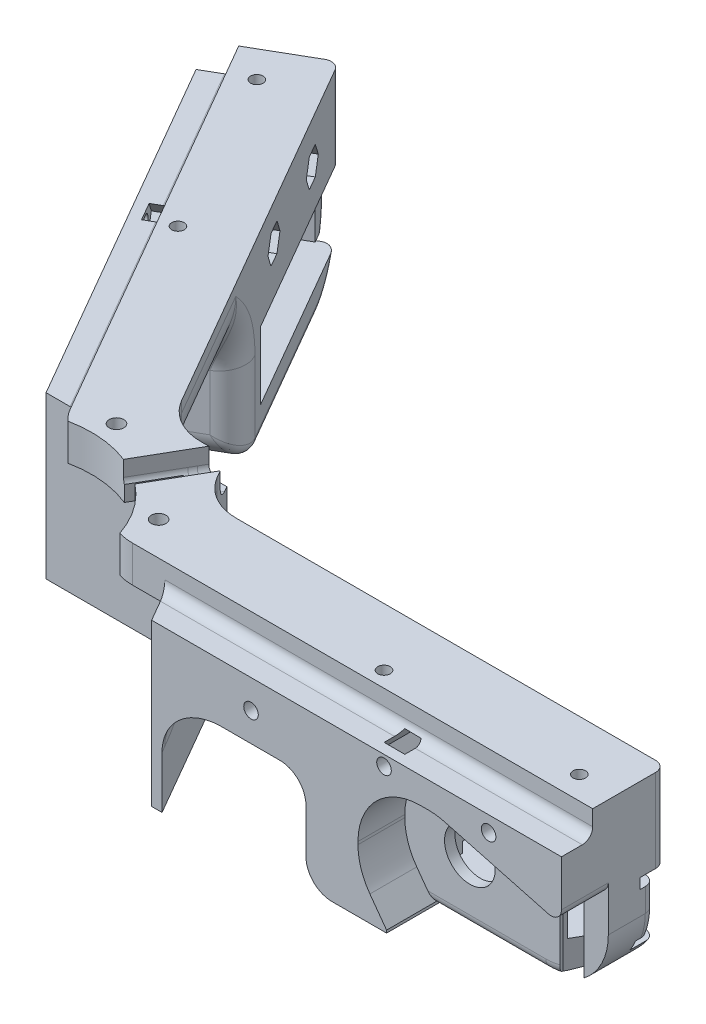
SolidWorks part; units mm, degrees
ref_plane "Front Plane" through (0, 0, 0) normal (0, 0, 1) x (1, 0, 0)
ref_plane "Top Plane" through (0, 0, 0) normal (0, 1, 0) x (1, 0, 0)
ref_plane "Right Plane" through (0, 0, 0) normal (1, 0, 0) x (0, 0, -1)
sketch "Sketch1" plane through (0, 0, 0) normal (0, 0, 1) x (1, 0, 0)
  line L0 (39.1, 12) -> (12.5, 12) construction
  line L3 (0, 32.5) -> (39.1, 32.5)
  line L5 (0, 0) -> (12, 0) construction
  line L6 (39.1, 0) -> (27.1, 0) construction
  line L8 (39.1, 32.5) -> (39.1, 12)
  line L9 (12, 0) -> (27.1, 0)
  line L12 (0, 32.5) -> (0, 0)
  line L13 (12, 0) -> (0, 0)
  circle A0 centre (12.5, 12) radius 4.875
  arc A2 (39.1, 12) -> (27.1, 0) centre (27.1, 12) cw
  dimension "D4" = 9.75
  dimension "D7" = 12
  dimension "D5" = 27.1
  dimension "D1" = 32.5
  dimension "D2" = 39.1
  dimension "D3" = 12.5
  dimension "D8" = 15.1
  dimension "D13" = 12
extrude "Boss-Extrude1" add sketch "Sketch1" along normal blind 2
sketch "Sketch2" plane through (0, 0, 2) normal (0, 0, 1) x (1, 0, 0)
  line L0 (15.1, 24.5) -> (39.1, 18.0692)
  line L5 (0, 32.5) -> (0, 0) construction
  line L6 (39.1, 32.5) -> (0, 32.5)
  line L8 (15.1, 24.5) -> (0, 24.5)
  line L10 (0, 32.5) -> (0, 24.5)
  line L11 (39.1, 12) -> (39.1, 32.5) construction
  line L12 (39.1, 32.5) -> (39.1, 18.0692)
  dimension "D1" = 8
  dimension "D2" = 15
  dimension "D3" = 24
extrude "Boss-Extrude2" add sketch "Sketch2" along normal blind 9
sketch "Sketch4" plane through (0, 0, 0) normal (0, 0, -1) x (-1, 0, 0)
  line L0 (-5, 5.5) -> (-34.1, 5.5)
  line L1 (-34.1, 18.5) -> (-5, 18.5)
  line L3 (-34.1, 5.5) -> (-34.1, 18.5)
  line L4 (-39.1, 32.5) -> (-39.1, 12)
  line L5 (-27.1, 0) -> (0, 0)
  line L6 (0, 0) -> (0, 32.5)
  line L7 (0, 32.5) -> (-39.1, 32.5)
  line L8 (-39.1, 32.5) -> (-39.1, 12)
  line L9 (-27.1, 0) -> (0, 0)
  line L11 (0, 32.5) -> (-39.1, 32.5)
  line L14 (-5, 18.5) -> (-5, 5.5)
  line L21 (0, 0) -> (0, 32.5)
  arc A2 (-39.1, 12) -> (-27.1, 0) centre (-27.1, 12) ccw
  arc A4 (-39.1, 12) -> (-27.1, 0) centre (-27.1, 12) ccw
  dimension "D2" = 5.5
  dimension "D3" = 14
  dimension "D4" = 29.1
  dimension "D5" = 5
  dimension "D1" = 0
extrude "Boss-Extrude4" add sketch "Sketch4" along normal blind 7.1
sketch "Sketch18" plane through (0, 0, -7.1) normal (0, 0, -1) x (-1, 0, 0)
  line L2 (-34.1, 5.5) -> (-37.1871, 5.5)
  line L3 (-34.1, 5.5) -> (0, 5.5)
  line L6 (0, 32.5) -> (-39.1, 32.5)
  line L9 (-39.1, 32.5) -> (-39.1, 12)
  line L10 (-27.1, 0) -> (0, 0)
  line L11 (0, 0) -> (0, 32.5)
  line L12 (0, 32.5) -> (-39.1, 32.5)
  line L15 (-39.1, 32.5) -> (-39.1, 18.5)
  line L16 (-27.1, 0) -> (0, 0)
  line L17 (0, 0) -> (0, 5.5)
  line L18 (-39.1, 18.5) -> (0, 18.5)
  line L19 (0, 0) -> (0, 32.5) construction
  line L20 (0, 18.5) -> (0, 32.5)
  arc A3 (-39.1, 12) -> (-27.1, 0) centre (-27.1, 12) ccw
  arc A6 (-37.1871, 5.5) -> (-27.1, 0) centre (-27.1, 12) ccw
  dimension "D1" = 0
extrude "Boss-Extrude7" add sketch "Sketch18" along normal blind 2
sketch "Sketch69" plane through (0, 0, -7.1) normal (0, 0, -1) x (-1, 0, 0)
  line L0 (0, 12) -> (-39.1, 12) construction
  line L1 (0, 5.5) -> (-50, 5.5)
  line L2 (0, 5.5) -> (0, 7.5)
  line L3 (0, 7.5) -> (-50, 7.5)
  line L4 (-50, 5.5) -> (-50, 7.5)
  line L5 (0, 5.5) -> (0, 18.5) construction
  line L6 (0, 16.5) -> (-50, 16.5)
  line L7 (-50, 18.5) -> (-50, 16.5)
  line L8 (0, 18.5) -> (-50, 18.5)
  line L9 (0, 18.5) -> (0, 16.5)
  arc A0 (-39.1, 12) -> (-37.1871, 5.5) centre (-27.1, 12) ccw construction
  dimension "D1" = 2
  dimension "D2" = 50
extrude "Cut-Extrude1" cut sketch "Sketch69" against normal blind 3
sketch "Sketch70" plane through (0, 0, 11) normal (0, 0, 1) x (1, 0, 0)
  line L0 (5, 27.5) -> (0, 27.5) construction
  line L1 (0, 32.5) -> (0, 24.5) construction
  line L2 (39.1, 18.0692) -> (39.1, 32.5) construction
  line L3 (25.1, 26.5) -> (39.1, 26.5) construction
  line L4 (39.1, 32.5) -> (0, 32.5) construction
  circle A0 centre (25.1, 26.5) radius 1.4
  circle A1 centre (5, 27.5) radius 1.4
  dimension "D2" = 2.8
  dimension "D1" = 14
  dimension "D3" = 5
  dimension "D4" = 5
  dimension "D5" = 6
extrude "Cut-Extrude2" cut sketch "Sketch70" against normal up to next
sketch "Sketch71" plane through (0, 0, -9.1) normal (0, 0, -1) x (-1, 0, 0)
  line L0 (0, 32.5) -> (-39.1, 32.5) construction
  line L1 (-3.3973, 24.7922) -> (-1.8536, 27.5341)
  line L2 (-1.8536, 27.5341) -> (-3.4564, 30.2419)
  line L3 (-3.4564, 30.2419) -> (-6.6027, 30.2078)
  line L4 (-6.6027, 30.2078) -> (-8.1464, 27.4659)
  line L5 (-8.1464, 27.4659) -> (-6.5436, 24.7581)
  line L6 (-6.5436, 24.7581) -> (-3.3973, 24.7922)
  line L7 (-21.9534, 26.5) -> (-23.5267, 29.225)
  line L8 (-23.5267, 29.225) -> (-26.6733, 29.225)
  line L9 (-26.6733, 29.225) -> (-28.2466, 26.5)
  line L10 (-28.2466, 26.5) -> (-26.6733, 23.775)
  line L11 (-26.6733, 23.775) -> (-23.5267, 23.775)
  line L12 (-23.5267, 23.775) -> (-21.9534, 26.5)
  circle A0 centre (-5, 27.5) radius 2.725 construction
  circle A1 centre (-25.1, 26.5) radius 2.725 construction
  dimension "D1" = 5.45
extrude "Cut-Extrude3" cut sketch "Sketch71" against normal blind 18.1
sketch "Sketch72" plane through (0, 32.5, 0) normal (0, 1, 0) x (1, 0, 0)
  line L0 (32.1, -11) -> (32.1, -0.57) construction
  line L1 (39.1, -11) -> (0, -11) construction
  line L2 (39.1, -11) -> (39.1, 9.1) construction
  circle A0 centre (32.1, -0.57) radius 1.55
  dimension "D3" = 3.1
  dimension "D1" = 10.43
  dimension "D2" = 7
extrude "Cut-Extrude4" cut sketch "Sketch72" against normal up to next
sketch "Sketch73" plane through (0, 18.5, 0) normal (0, -1, 0) x (1, 0, 0)
  line L0 (5, 0) -> (30.6586, 0) construction
  line L1 (30.5267, -2.155) -> (33.6733, -2.155)
  line L2 (33.6733, -2.155) -> (35.2466, 0.57)
  line L3 (35.2466, 0.57) -> (33.6733, 3.295)
  line L4 (33.6733, 3.295) -> (30.5267, 3.295)
  line L5 (30.5267, 3.295) -> (28.9534, 0.57)
  line L6 (28.9534, 0.57) -> (30.5267, -2.155)
  circle A1 centre (32.1, 0.57) radius 2.725 construction
  dimension "D1" = 5.45
extrude "Cut-Extrude5" cut sketch "Sketch73" against normal blind 14 and the other way up to next
sketch "Sketch74" plane through (0, 0, 0) normal (-1, 0, 0) x (0, 0, 1)
  line L14 (-4.1, 7.5) -> (-4.1, 5.5)
  line L15 (-4.1, 5.5) -> (-9.1, 5.5)
  line L16 (-9.1, 5.5) -> (-9.1, 0)
  line L17 (-9.1, 0) -> (2, 0)
  line L18 (2, 0) -> (2, 24.5)
  line L19 (2, 24.5) -> (11, 24.5)
  line L20 (11, 24.5) -> (11, 32.5)
  line L21 (11, 32.5) -> (-9.1, 32.5)
  line L22 (-9.1, 32.5) -> (-9.1, 18.5)
  line L23 (-9.1, 18.5) -> (-4.1, 18.5)
  line L24 (-4.1, 18.5) -> (-4.1, 16.5)
  line L25 (-4.1, 16.5) -> (-7.1, 16.5)
  line L26 (-7.1, 16.5) -> (-7.1, 7.5)
  line L27 (-7.1, 7.5) -> (-4.1, 7.5)
  line L28 (-4.1, 7.5) -> (-4.1, 5.5)
  line L29 (-4.1, 5.5) -> (-9.1, 5.5)
  line L30 (-9.1, 5.5) -> (-9.1, 0)
  line L31 (-9.1, 0) -> (2, 0)
  line L32 (2, 0) -> (2, 24.5)
  line L33 (2, 24.5) -> (11, 24.5)
  line L34 (11, 24.5) -> (11, 32.5)
  line L35 (11, 32.5) -> (-9.1, 32.5)
  line L36 (-9.1, 32.5) -> (-9.1, 18.5)
  line L37 (-9.1, 18.5) -> (-4.1, 18.5)
  line L38 (-4.1, 18.5) -> (-4.1, 16.5)
  line L39 (-4.1, 16.5) -> (-7.1, 16.5)
  line L40 (-7.1, 16.5) -> (-7.1, 7.5)
  line L41 (-7.1, 7.5) -> (-4.1, 7.5)
  dimension "D1" = 0
extrude "Boss-Extrude8" add sketch "Sketch74" along normal blind 10
sketch "Sketch80" plane through (0, 0, 2) normal (0, 0, 1) x (1, 0, 0)
  line L0 (-10, 0) -> (27.1, 0) construction
  line L1 (-10, 24.5) -> (0, 24.5)
  line L2 (-10, 24.5) -> (-10, 0)
  line L5 (0, 12.5) -> (-10, 12.5) construction
  line L6 (0, 8.0701) -> (0, 24.5)
  line L10 (5.5, 0.5) -> (5.5, 0)
  line L11 (5.5, 0.5) -> (0, 8.0701)
  line L12 (-10, 0) -> (5.5, 0)
  dimension "D1" = 10
  dimension "D2" = 12
  dimension "D3" = 0.5
  dimension "D4" = 15.5
  dimension "D5" = 54
extrude "Boss-Extrude9" add sketch "Sketch80" along normal blind 9
fillet "Fillet1" radius 12 3 edges at (0, 24.5, 6.5) (0, 8.0701, 6.5) (15.1, 24.5, 6.5)
sketch "Sketch86" plane through (0, 32.5, 0) normal (0, 1, 0) x (1, 0, 0)
  line L0 (39.1, -11) -> (-10, -11) construction
  line L1 (-10, -11) -> (-10, 9.1) construction
  circle A0 centre (-4, -2) radius 1.4
  dimension "D3" = 2.8
  dimension "D1" = 9
  dimension "D2" = 6
extrude "Cut-Extrude10" cut sketch "Sketch86" against normal up to next
sketch "Sketch88" plane through (0, 0, 0) normal (0, -1, 0) x (1, 0, 0)
  line L0 (-10, 11) -> (5.5, 11) construction
  line L1 (-2.4267, 4.725) -> (-5.5733, 4.725)
  line L2 (-5.5733, 4.725) -> (-7.1466, 2)
  line L3 (-7.1466, 2) -> (-5.5733, -0.725)
  line L4 (-5.5733, -0.725) -> (-2.4267, -0.725)
  line L5 (-2.4267, -0.725) -> (-0.8534, 2)
  line L6 (-0.8534, 2) -> (-2.4267, 4.725)
  circle A2 centre (-4, 2) radius 2.725 construction
  dimension "D1" = 5.45
extrude "Cut-Extrude12" cut sketch "Sketch88" against normal blind 32.5
sketch "Sketch93" plane through (-10, 0, 0) normal (-1, 0, 0) x (0, 0, 1)
  line L1 (-9.1, 18.5) -> (-4.1, 18.5)
  line L2 (-9.1, 18.5) -> (-9.1, 5.5)
  line L3 (-9.1, 5.5) -> (-4.1, 5.5)
  line L4 (-4.1, 18.5) -> (-4.1, 5.5)
extrude "Boss-Extrude11" add sketch "Sketch93" against normal blind 8
sketch "Sketch94" plane through (0, 32.5, 0) normal (0, 1, 0) x (1, 0, 0)
  line L0 (39.1, -11) -> (-10, -11) construction
  line L1 (-10, -11) -> (-71.65, -11) construction
  dimension "D1" = 110.75
sketch "Sketch95" plane through (-10, 0, 0) normal (-1, 0, 0) x (0, 0, 1)
  line L5 (11, 0) -> (11, 32.5) construction
  line L6 (-9.1, 32.5) -> (11, 32.5)
  line L7 (-9.1, 32.5) -> (-9.1, 18.5)
  line L8 (-9.1, 18.5) -> (11, 18.5)
  line L9 (11, 32.5) -> (11, 18.5)
  dimension "D1" = 14
extrude "Boss-Extrude12" add sketch "Sketch95" along normal blind 61.65
sketch "Sketch99" plane through (0, 32.5, 0) normal (0, 1, 0) x (1, 0, 0)
  line L0 (-71.65, -11) -> (-60.0453, 9.1)
  line L1 (-71.65, 9.1) -> (39.1, 9.1) construction
  line L3 (-60.0453, 9.1) -> (-71.65, 9.1)
  line L4 (-71.65, 9.1) -> (-71.65, -11)
  dimension "D1" = 30
extrude "Cut-Extrude14" cut sketch "Sketch99" against normal through all
fillet "Fillet4" radius 2 7 edges at (28.4481, 0.076, 2) (29.3676, 0.2162, 1.2874) (16.3, 0, 2) (5.5, 0.25, 2) (39.1, 25.5, -9.1) (32.8446, 1.4643, -9.1) (8.55, 0, -9.1)
fillet "Fillet5" radius 2 1 edges at (39.1, 18.0692, 6.5)
mirror "Mirror1" about plane through (-71.65, 0, 11) normal (0.866, 0, 0.5)
sketch "Sketch101" plane through (0, 18.5, 0) normal (0, -1, 0) x (1, 0, 0)
  line L0 (-37.65, 11) -> (-71.65, 11)
  line L5 (-88.65, -18.4449) -> (-54.65, -18.4449)
  line L6 (-54.65, -18.4449) -> (-37.65, 11)
  line L7 (-88.65, -18.4449) -> (-71.65, 11)
  line L9 (-63.039, 54.975) -> (-74.289, 74.4606)
  line L10 (-105.428, 40.4449) -> (-127.928, 40.4449)
  line L11 (-114.039, -3.5302) -> (-125.289, -23.0157)
  line L12 (-114.039, 25.5302) -> (-102.789, 6.0446)
  dimension "D1" = 34
  dimension "D2" = 34
  dimension "D3" = 34
extrude "Boss-Extrude13" add sketch "Sketch101" against normal blind 14
sketch "Sketch102" plane through (0, 18.5, 0) normal (0, -1, 0) x (1, 0, 0)
  line L0 (-39.65, 11) -> (-71.65, 11)
  line L5 (-87.65, -16.7128) -> (-55.65, -16.7128)
  line L6 (-55.65, -16.7128) -> (-39.65, 11)
  line L7 (-87.65, -16.7128) -> (-71.65, 11)
  line L9 (-112.0893, 25.6173) -> (-90.5893, -11.6218)
  line L10 (-79.2107, 53.3301) -> (-89.9607, 34.7105)
  line L11 (-38.7714, 38.7128) -> (-60.2714, 38.7128)
  line L12 (-31.2107, -3.6173) -> (-41.9607, 15.0023)
  dimension "D1" = 32
  dimension "D2" = 32
  dimension "D3" = 32
extrude "Cut-Extrude15" cut sketch "Sketch102" against normal blind 12
sketch "Sketch103" plane through (0, 30.5, 0) normal (0, -1, 0) x (1, 0, 0)
  line L0 (-54.65, -18.4449) -> (-56.65, -14.9808) construction
  line L1 (-65.4405, -18.4449) -> (-54.65, -18.4449) construction
  circle A0 centre (-56.65, -14.9808) radius 3
  dimension "D3" = 6
  dimension "D1" = 4
  dimension "D2" = 60
extrude "Boss-Extrude14" add sketch "Sketch103" along normal blind 12
sketch "Sketch106" plane through (0, 18.5, 0) normal (0, -1, 0) x (1, 0, 0)
  circle A0 centre (-56.65, -14.9808) radius 1.2
  dimension "D1" = 2.4
extrude "Cut-Extrude17" cut sketch "Sketch106" against normal through all
fillet "Fillet6" radius 13.9 2 edges at (-75.2542, 18.5, -35.4427) (-29.6274, 18.5, -9.1)
fillet "Fillet10" radius 5 14 edges at (-6.3599, 0, 3.3625) (-6.3599, 0, 0.6375) (-10, 17.2, -9.1) (-10, 0, 1.95) (-10, 0.5858, -8.5142) (-97.6808, 0, -49.3616) (-95.3209, 0, -50.7241) (-94.6375, 0, -46.9155) (-85.0679, 17.2, -52.4405) (-85.5752, 0.5858, -52.1476) (-99.7903, 18.5, -43.9405) (-10, 18.5, 7.9) (-10, 22.5712, -5.0288) (-88.5937, 22.5712, -50.4049)
sketch "Sketch108" plane through (0, 30.5, 0) normal (0, -1, 0) x (1, 0, 0)
  line L0 (-71.65, 11) -> (-87.65, -16.7128) construction
  line L1 (-81.65, -6.3205) -> (-61.65, -6.3205)
  line L2 (-61.65, -6.3205) -> (-51.65, 11)
  line L3 (-51.65, 11) -> (-61.65, 28.3205)
  line L4 (-61.65, 28.3205) -> (-81.65, 28.3205)
  line L5 (-81.65, 28.3205) -> (-91.65, 11)
  line L6 (-91.65, 11) -> (-81.65, -6.3205)
  circle A0 centre (-71.65, 11) radius 17.3205 construction
  dimension "D1" = 20
extrude "Cut-Extrude19" cut sketch "Sketch108" against normal through all
sketch "Sketch109" plane through (39.1, 0, 0) normal (1, 0, 0) x (0, 0, -1)
  line L1 (-11, 32.5) -> (-5, 32.5)
  line L2 (-11, 32.5) -> (-11, 29.5)
  line L3 (-11, 29.5) -> (-5, 29.5)
  line L4 (-5, 32.5) -> (-5, 29.5)
  dimension "D1" = 3
  dimension "D2" = 6
extrude "Cut-Extrude20" cut sketch "Sketch109" against normal through all
sketch "Sketch110" plane through (0, 0, 11) normal (0, 0, 1) x (1, 0, 0)
  line L0 (-71.65, 32.5) -> (-71.65, 12.5) construction
  dimension "D1" = 20
sketch "Sketch111" plane through (-68.5244, 0, -118.6877) normal (-0.5, 0, -0.866) x (-0.866, 0, 0.5)
  line L1 (67.5507, 32.5) -> (61.5507, 32.5)
  line L2 (67.5507, 32.5) -> (67.5507, 29.5)
  line L3 (67.5507, 29.5) -> (61.5507, 29.5)
  line L4 (61.5507, 32.5) -> (61.5507, 29.5)
  dimension "D1" = 3
  dimension "D2" = 6
extrude "Cut-Extrude21" cut sketch "Sketch111" against normal through all
sketch "Sketch112" plane through (0, 18.5, 0) normal (0, -1, 0) x (1, 0, 0)
  line L0 (-41.2296, 4.8) -> (-37.65, 11)
  line L1 (-81.4909, -18.4449) -> (-88.65, -18.4449)
  line L10 (-87.65, -16.7128) -> (-99.975, -38.0603)
  line L11 (-99.975, -38.0603) -> (-94.6056, -41.1603)
  line L12 (-94.6056, -41.1603) -> (-81.4909, -18.4449)
  line L13 (-81.4909, -18.4449) -> (-54.65, -18.4449)
  line L14 (-54.65, -18.4449) -> (-41.2296, 4.8)
  line L15 (-41.2296, 4.8) -> (-15, 4.8)
  line L16 (-15, 4.8) -> (-15, 11)
  line L17 (-15, 11) -> (-39.65, 11)
  line L18 (-39.65, 11) -> (-53.9253, -13.7255)
  line L19 (-59.0995, -16.7128) -> (-87.65, -16.7128)
  line L20 (-87.65, -16.7128) -> (-88.65, -18.4449)
  line L23 (-81.4909, -18.4449) -> (-54.65, -18.4449)
  line L24 (-54.65, -18.4449) -> (-41.2296, 4.8)
  line L27 (-37.65, 11) -> (-39.65, 11)
  line L28 (-39.65, 11) -> (-53.9253, -13.7255)
  line L29 (-59.0995, -16.7128) -> (-87.65, -16.7128)
  circle A1 centre (-56.65, -14.9808) radius 1.2
  arc A4 (-53.9253, -13.7255) -> (-59.0995, -16.7128) centre (-56.65, -14.9808) ccw
  arc A5 (-53.9253, -13.7255) -> (-59.0995, -16.7128) centre (-56.65, -14.9808) ccw
  circle A6 centre (-56.65, -14.9808) radius 1.2 construction
  dimension "D1" = 0
extrude "Boss-Extrude15" add sketch "Sketch112" along normal blind 20
fillet "Fillet12" radius 10 6 edges at (-49.2547, 32.45, -9.1) (-39.4398, 18.5, 7.9) (-85.0704, 18.5, -18.4449) (-65.4405, 32.45, -18.4449) (-46.9042, 22.5712, -5.0288) (-70.1416, 22.5712, -18.4449)
fillet "Fillet13" radius 10 3 edges at (-74.7218, 31.5, -6.3205) (-55.1141, 31.5, 5) (-61.65, 31.5, -6.3205)
sketch "Sketch115" plane through (0, 32.5, 0) normal (0, 1, 0) x (1, 0, 0)
  line L0 (-95.3209, 50.7241) -> (-100.0407, 53.4491) construction
  line L1 (-96.1075, 49.3616) -> (-94.5342, 52.0866) construction
  line L2 (-99.2541, 54.8116) -> (-100.8273, 52.0866) construction
  line L3 (-97.6808, 52.0866) -> (-96.1075, 54.8116) construction
  line L4 (-0.8534, -2) -> (-7.1466, -2) construction
  line L5 (-4, -2) -> (-4, 0.725) construction
  line L6 (-5.5733, 0.725) -> (-2.4267, 0.725) construction
  line L7 (35.2466, -0.57) -> (28.9534, -0.57) construction
  line L8 (32.1, -0.57) -> (32.1, -3.295) construction
  line L9 (33.6733, -3.295) -> (30.5267, -3.295) construction
  line L10 (-121.8288, 87.9123) -> (-77.6085, 11.3205)
  line L11 (-68.9483, 6.3205) -> (-67.4235, 6.3205)
  line L12 (-58.7632, 1.3205) -> (-58.0009, 0)
  line L13 (-49.3406, -5) -> (39.1, -5)
  line L14 (39.1, -5) -> (39.1, 7.1)
  line L15 (37.1, 9.1) -> (-43.4812, 9.1)
  line L16 (-52.1415, 14.1) -> (-54.65, 18.4449)
  line L17 (-54.65, 18.4449) -> (-59.667, 18.4449)
  line L18 (-68.3273, 23.4449) -> (-108.6179, 93.2303)
  line L19 (-111.3499, 93.9623) -> (-121.8288, 87.9123)
  line L20 (-121.8288, 87.9123) -> (-77.6085, 11.3205)
  line L21 (-68.9483, 6.3205) -> (-67.4235, 6.3205)
  line L22 (-58.7632, 1.3205) -> (-58.0009, 0)
  line L23 (-49.3406, -5) -> (39.1, -5)
  line L24 (39.1, -5) -> (39.1, 7.1)
  line L25 (37.1, 9.1) -> (-43.4812, 9.1)
  line L26 (-52.1415, 14.1) -> (-54.65, 18.4449)
  line L27 (-54.65, 18.4449) -> (-59.667, 18.4449)
  line L28 (-68.3273, 23.4449) -> (-108.6179, 93.2303)
  line L29 (-111.3499, 93.9623) -> (-121.8288, 87.9123)
  line L30 (-112.9191, 81.3401) -> (-116.0656, 86.7901) construction
  line L31 (-114.4924, 84.0651) -> (-112.1324, 85.4276) construction
  line L32 (-111.3458, 84.0651) -> (-112.9191, 86.7901) construction
  circle A0 centre (32.1, -0.57) radius 1.2
  circle A1 centre (-4, -2) radius 1.2
  circle A2 centre (-56.65, 14.9808) radius 1.2
  circle A3 centre (-97.6808, 52.0866) radius 1.2
  circle A4 centre (-114.4924, 84.0651) radius 1.2
  circle A6 centre (-56.65, 14.9808) radius 1.2 construction
  arc A7 (-77.6085, 11.3205) -> (-68.9483, 6.3205) centre (-68.9483, 16.3205) ccw
  arc A8 (-58.7632, 1.3205) -> (-67.4235, 6.3205) centre (-67.4235, -3.6795) ccw
  arc A9 (-58.0009, 0) -> (-49.3406, -5) centre (-49.3406, 5) ccw
  arc A10 (39.1, 7.1) -> (37.1, 9.1) centre (37.1, 7.1) ccw
  arc A11 (-52.1415, 14.1) -> (-43.4812, 9.1) centre (-43.4812, 19.1) ccw
  arc A12 (-68.3273, 23.4449) -> (-59.667, 18.4449) centre (-59.667, 28.4449) ccw
  arc A13 (-108.6179, 93.2303) -> (-111.3499, 93.9623) centre (-110.3499, 92.2303) ccw
  arc A14 (-77.6085, 11.3205) -> (-68.9483, 6.3205) centre (-68.9483, 16.3205) ccw
  arc A15 (-58.7632, 1.3205) -> (-67.4235, 6.3205) centre (-67.4235, -3.6795) ccw
  arc A16 (-58.0009, 0) -> (-49.3406, -5) centre (-49.3406, 5) ccw
  arc A17 (39.1, 7.1) -> (37.1, 9.1) centre (37.1, 7.1) ccw
  arc A18 (-52.1415, 14.1) -> (-43.4812, 9.1) centre (-43.4812, 19.1) ccw
  arc A19 (-68.3273, 23.4449) -> (-59.667, 18.4449) centre (-59.667, 28.4449) ccw
  arc A20 (-108.6179, 93.2303) -> (-111.3499, 93.9623) centre (-110.3499, 92.2303) ccw
  dimension "D1" = 0
extrude "Boss-Extrude16" add sketch "Sketch115" along normal blind 2
sketch "Sketch116" plane through (0, 30.5, 0) normal (0, -1, 0) x (1, 0, 0)
  line L0 (-58.7632, -1.3205) -> (-58.0009, 0) construction
  line L1 (-68.9483, -6.3205) -> (-67.4235, -6.3205) construction
  circle A0 centre (-50.7554, -1.4506) radius 1.4
  circle A1 centre (-70.7218, -13.3205) radius 1.4
  dimension "D1" = 7
  dimension "D5" = 2.8
  dimension "D2" = 7
  dimension "D3" = 10
  dimension "D4" = 10
extrude "Cut-Extrude22" cut sketch "Sketch116" against normal through all
sketch "Sketch117" plane through (0, 30.5, 0) normal (0, -1, 0) x (-1, 0, 0)
  line L0 (58.7632, 1.3205) -> (58.0009, 0) construction
  line L1 (52.3287, -1.2744) -> (53.902, 1.4506)
  line L2 (53.902, 1.4506) -> (52.3287, 4.1756)
  line L3 (52.3287, 4.1756) -> (49.1822, 4.1756)
  line L4 (49.1822, 4.1756) -> (47.6089, 1.4506)
  line L5 (47.6089, 1.4506) -> (49.1822, -1.2744)
  line L6 (49.1822, -1.2744) -> (52.3287, -1.2744)
  line L7 (68.9483, 6.3205) -> (67.4235, 6.3205) construction
  line L8 (72.2951, 10.5955) -> (73.8684, 13.3205)
  line L9 (73.8684, 13.3205) -> (72.2951, 16.0455)
  line L10 (72.2951, 16.0455) -> (69.1485, 16.0455)
  line L11 (69.1485, 16.0455) -> (67.5752, 13.3205)
  line L12 (67.5752, 13.3205) -> (69.1485, 10.5955)
  line L13 (69.1485, 10.5955) -> (72.2951, 10.5955)
  circle A0 centre (50.7554, 1.4506) radius 2.725 construction
  circle A1 centre (70.7218, 13.3205) radius 2.725 construction
  dimension "D1" = 5.45
extrude "Cut-Extrude23" cut sketch "Sketch117" against normal blind 2
sketch "Sketch118" plane through (0, 34.5, 0) normal (0, 1, 0) x (1, 0, 0)
  line L0 (-62.4235, 4.9808) -> (-54.65, 18.4449) construction
  line L1 (-57.2481, 19.9449) -> (-52.0519, 16.9449)
  line L2 (-52.0519, 16.9449) -> (-59.5519, 3.9545)
  line L3 (-59.5519, 3.9545) -> (-64.7481, 6.9545)
  line L4 (-62.15, 5.4545) -> (-62.4235, 4.9808) construction
  line L5 (-57.2481, 19.9449) -> (-64.7481, 6.9545)
  arc A1 (-58.7632, 1.3205) -> (-67.4235, 6.3205) centre (-67.4235, -3.6795) ccw construction
  dimension "D1" = 3
  dimension "D2" = 15
extrude "Cut-Extrude24" cut sketch "Sketch118" against normal blind 5
fillet "Fillet14" radius 2 2 edges at (-53.9253, 14, -13.7255) (-59.0995, 14, -16.7128)
fillet "Fillet15" radius 2 2 edges at (-58.9613, 29.5, -16.9774) (-53.7652, 29.5, -13.9774)
fillet "Fillet16" radius 2 2 edges at (-113.8041, 29.5, -74.0131) (23.0506, 29.5, 5)
sketch "Sketch119" plane through (0, -1.5, 0) normal (0, -1, 0) x (1, 0, 0)
  line L0 (-54.65, -18.4449) -> (-71.65, 11) construction
  circle A0 centre (-71.65, 11) radius 20.5
  dimension "D1" = 41
extrude "Cut-Extrude25" cut sketch "Sketch119" against normal through all
sketch "Sketch120" plane through (0, 30.5, 0) normal (0, -1, 0) x (1, 0, 0)
  line L6 (-67.5752, -13.3205) -> (-69.1485, -10.5955)
  line L7 (-69.1485, -10.5955) -> (-72.2951, -10.5955)
  line L8 (-77.6085, -11.3205) -> (-80.7218, -16.7128)
  line L9 (-80.7218, -16.7128) -> (-61.6428, -16.7128)
  line L10 (-59.6957, -15.1696) -> (-63.8575, -7.9612)
  line L11 (-77.6085, -11.3205) -> (-80.7218, -16.7128)
  line L12 (-80.7218, -16.7128) -> (-61.6428, -16.7128)
  line L13 (-59.6957, -15.1696) -> (-63.8575, -7.9612)
  line L14 (-59.1254, -5.2291) -> (-54.9636, -12.4375)
  line L15 (-52.6536, -11.5229) -> (-43.1141, 5)
  line L16 (-43.1141, 5) -> (-49.3406, 5)
  line L17 (-59.1254, -5.2291) -> (-54.9636, -12.4375)
  line L18 (-52.6536, -11.5229) -> (-43.1141, 5)
  line L19 (-43.1141, 5) -> (-49.3406, 5)
  line L20 (-72.2951, -10.5955) -> (-73.8684, -13.3205)
  line L21 (-73.8684, -13.3205) -> (-72.2951, -16.0455)
  line L22 (-72.2951, -16.0455) -> (-69.1485, -16.0455)
  line L23 (-69.1485, -16.0455) -> (-67.5752, -13.3205)
  line L24 (-47.6089, -1.4506) -> (-49.1822, 1.2744)
  line L25 (-49.1822, 1.2744) -> (-52.3287, 1.2744)
  line L26 (-52.3287, 1.2744) -> (-53.902, -1.4506)
  line L27 (-53.902, -1.4506) -> (-52.3287, -4.1756)
  line L28 (-52.3287, -4.1756) -> (-49.1822, -4.1756)
  line L29 (-49.1822, -4.1756) -> (-47.6089, -1.4506)
  circle A2 centre (-70.7218, -13.3205) radius 2.725 construction
  circle A3 centre (-50.7554, -1.4506) radius 2.725 construction
  arc A5 (-75.8337, -9.0685) -> (-63.8575, -7.9612) centre (-71.65, 11) ccw
  arc A6 (-75.8337, -9.0685) -> (-77.6085, -11.3205) centre (-68.9483, -16.3205) ccw
  arc A7 (-61.6428, -16.7128) -> (-59.6957, -15.1696) centre (-61.6428, -14.7128) ccw
  arc A8 (-75.8337, -9.0685) -> (-63.8575, -7.9612) centre (-71.65, 11) ccw
  arc A9 (-75.8337, -9.0685) -> (-77.6085, -11.3205) centre (-68.9483, -16.3205) ccw
  arc A10 (-61.6428, -16.7128) -> (-59.6957, -15.1696) centre (-61.6428, -14.7128) ccw
  arc A11 (-59.1254, -5.2291) -> (-52.1783, 4.5889) centre (-71.65, 11) ccw
  arc A12 (-54.9636, -12.4375) -> (-52.6536, -11.5229) centre (-54.3856, -10.5229) ccw
  arc A13 (-49.3406, 5) -> (-52.1783, 4.5889) centre (-49.3406, -5) ccw
  arc A14 (-59.1254, -5.2291) -> (-52.1783, 4.5889) centre (-71.65, 11) ccw
  arc A15 (-54.9636, -12.4375) -> (-52.6536, -11.5229) centre (-54.3856, -10.5229) ccw
  arc A16 (-49.3406, 5) -> (-52.1783, 4.5889) centre (-49.3406, -5) ccw
  dimension "D3" = 5.45
  dimension "D1" = 0
  dimension "D2" = 0
extrude "Boss-Extrude17" add sketch "Sketch120" along normal blind 3
sketch "Sketch122" plane through (0, 0, 11) normal (0, 0, 1) x (1, 0, 0)
  line L0 (-20.5515, 18.5) -> (-20.5515, 29.5) construction
  line L1 (-26.103, 18.5) -> (-15, 18.5) construction
  line L2 (-39.65, 29.5) -> (39.1, 29.5) construction
  circle A0 centre (-20.5515, 24) radius 1.4
  circle A1 centre (5, 27.5) radius 1.4 construction
extrude "Cut-Extrude27" cut sketch "Sketch122" against normal through all and the other way through all
sketch "Sketch123" plane through (0, 0, -9.1) normal (0, 0, -1) x (-1, 0, 0)
  line L0 (-37.1, 34.5) -> (43.4812, 34.5) construction
  line L1 (23.6981, 24) -> (22.1248, 26.725)
  line L2 (22.1248, 26.725) -> (18.9782, 26.725)
  line L3 (18.9782, 26.725) -> (17.4049, 24)
  line L4 (17.4049, 24) -> (18.9782, 21.275)
  line L5 (18.9782, 21.275) -> (22.1248, 21.275)
  line L6 (22.1248, 21.275) -> (23.6981, 24)
  circle A0 centre (20.5515, 24) radius 2.725 construction
  dimension "D1" = 5.45
extrude "Cut-Extrude28" cut sketch "Sketch123" against normal blind 18.1
sketch "Sketch124" plane through (-58.5006, 0, 33.7754) normal (-0.866, 0, 0.5) x (0.5, 0, 0.866)
  line L0 (-77.3972, 18.5) -> (-77.3972, 29.5) construction
  line L1 (-71.8457, 18.5) -> (-82.9487, 18.5) construction
  line L2 (-58.2987, 29.5) -> (-137.0487, 29.5) construction
  circle A0 centre (-77.3972, 24) radius 1.4
  dimension "D1" = 2.8
extrude "Cut-Extrude29" cut sketch "Sketch124" against normal through all
sketch "Sketch125" plane through (-41.0935, 0, 23.7254) normal (0.866, 0, -0.5) x (-0.5, 0, -0.866)
  line L0 (54.4675, 34.5) -> (135.0487, 34.5) construction
  line L1 (80.5438, 24) -> (78.9705, 26.725)
  line L2 (78.9705, 26.725) -> (75.8239, 26.725)
  line L3 (75.8239, 26.725) -> (74.2507, 24)
  line L4 (74.2507, 24) -> (75.8239, 21.275)
  line L5 (75.8239, 21.275) -> (78.9705, 21.275)
  line L6 (78.9705, 21.275) -> (80.5438, 24)
  circle A0 centre (77.3972, 24) radius 2.725 construction
  dimension "D1" = 5.45
extrude "Cut-Extrude30" cut sketch "Sketch125" against normal blind 18.1
sketch3d "3DSketch1"
  line L0 (12.5, 12, 2) -> (12.5, 12, 11) construction
  line L1 (12.5, 12, 2) -> (12.5, 12, 0) construction
  dimension "D1" = 9
